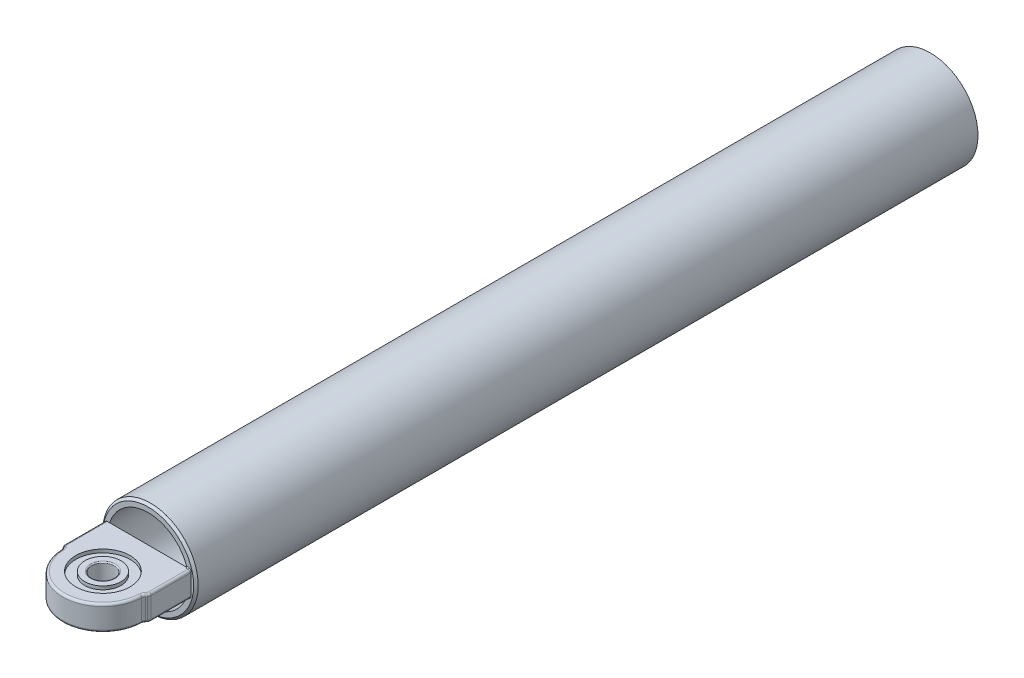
SolidWorks part; units mm, degrees
ref_plane "Front Plane" through (0, 0, 0) normal (0, 0, 1) x (1, 0, 0)
ref_plane "Top Plane" through (0, 0, 0) normal (0, 1, 0) x (1, 0, 0)
ref_plane "Right Plane" through (0, 0, 0) normal (1, 0, 0) x (0, 0, -1)
sketch "Sketch1" plane through (0, 0, 0) normal (0, 0, 1) x (1, 0, 0)
  circle A0 centre (0, 0) radius 21.065
  circle A1 centre (0, 0) radius 17.9222
  dimension "D1" = 42.13
extrude "Boss-Extrude1" add sketch "Sketch1" along normal mid plane 345.44
sketch "Sketch2" plane through (0, 0, 0) normal (0, 1, 0) x (1, 0, 0)
  line L0 (-21.065, -172.72) -> (21.065, -172.72) construction
  line L1 (-19.0226, -172.72) -> (18.9774, -172.72)
  line L2 (-19.0226, -172.72) -> (-19.0226, -190.4556)
  line L3 (-17.8026, -192.72) -> (17.7574, -192.72) construction
  line L4 (18.9774, -172.72) -> (18.9774, -190.4556)
  line L5 (-0.0226, -192.72) -> (-0.0226, -172.72) construction
  line L6 (-18.2062, -192.1964) -> (-18.6068, -191.6764)
  line L7 (-19.0226, -191.1369) -> (18.9774, -191.1369) construction
  line L8 (18.5615, -191.6764) -> (18.1609, -192.1964)
  arc A0 (-17.7916, -193.3467) -> (17.7463, -193.3467) centre (-0.0226, -192.72) ccw
  circle A1 centre (-0.0226, -192.72) radius 5
  arc A2 (-17.7916, -193.3467) -> (-18.2062, -192.1964) centre (-19.7903, -193.4172) ccw
  arc A3 (-18.6068, -191.6764) -> (-19.0226, -190.4556) centre (-17.0226, -190.4556) cw
  arc A4 (17.7463, -193.3467) -> (18.1609, -192.1964) centre (19.7451, -193.4172) cw
  arc A5 (18.9774, -190.4556) -> (18.5615, -191.6764) centre (16.9774, -190.4556) cw
  dimension "D2" = 17.78
  dimension "D1" = 10
  dimension "D3" = 2
  dimension "D4" = 20
  dimension "D5" = 38
extrude "Boss-Extrude2" add sketch "Sketch2" along normal mid plane 11
chamfer "Chamfer1" distance 1 1 edges at (21.065, 0, 172.72)
fillet "Fillet4" radius 0.5 2 edges at (18.0174, -5.5, 172.72) (18.0174, 5.5, 172.72)
fillet "Fillet1" radius 1 20 edges at (-19.0226, -5.5, 181.5878) (-18.9158, -5.5, 191.1005) (-18.4065, -5.5, 191.9364) (-17.9088, -5.5, 192.7391) (-0.0226, -5.5, 210.5) (17.8635, -5.5, 192.7391) (18.3612, -5.5, 191.9364) (18.8706, -5.5, 191.1005) (-19.0226, 5.5, 181.5878) (-18.9158, 5.5, 191.1005) (-18.4065, 5.5, 191.9364) (-17.9088, 5.5, 192.7391) (-0.0226, 5.5, 210.5) (17.8635, 5.5, 192.7391) (18.3612, 5.5, 191.9364) (18.8706, 5.5, 191.1005) (18.9774, -5.5, 181.8378) (18.9774, 5.5, 181.8378) (18.9774, -5.6464, 172.8664) (18.9774, 5.6464, 172.8664)
fillet "Fillet2" radius 0.5 2 edges at (-0.0226, -5.5, 197.72) (-0.0226, 5.5, 197.72)
sketch "Sketch3" plane through (0, 5.5, 0) normal (0, 1, 0) x (1, 0, 0)
  circle A0 centre (-0.0226, -192.72) radius 12
  circle A1 centre (-0.0226, -192.72) radius 8
  dimension "D1" = 16
  dimension "D2" = 4
extrude "Cut-Extrude1" cut sketch "Sketch3" against normal blind 1.5
mirror "Mirror1" about plane through (0, 0, 0) normal (0, 1, 0) of "Cut-Extrude1"
